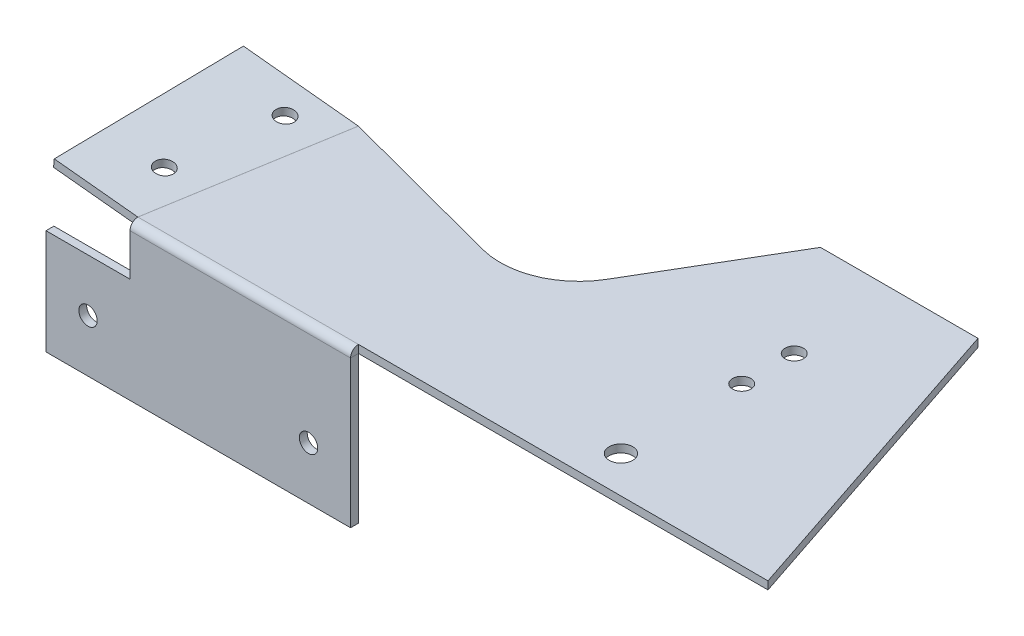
SolidWorks part; units mm, degrees
ref_plane "Front Plane" through (0, 0, 0) normal (0, 0, 1) x (1, 0, 0)
ref_plane "Top Plane" through (0, 0, 0) normal (0, 1, 0) x (1, 0, 0)
ref_plane "Right Plane" through (0, 0, 0) normal (1, 0, 0) x (0, 0, -1)
sketch "Sketch1" plane through (0, 0, 0) normal (0, 1, 0) x (1, 0, 0)
  line L0 (0, 0) -> (58, 0)
  line L1 (58, 0) -> (58, 28)
  line L2 (58, 28) -> (136, 28)
  line L3 (136, 28) -> (116, 88)
  line L4 (116, 88) -> (86, 88)
  line L5 (86, 88) -> (70.927, 62.3913)
  line L6 (54.167, 55.498) -> (22, 64)
  line L7 (22, 64) -> (0, 64)
  line L8 (0, 64) -> (0, 28)
  line L9 (0, 28) -> (16, 28)
  line L10 (16, 28) -> (16, 20)
  line L11 (16, 20) -> (0, 20)
  line L12 (0, 20) -> (0, 0)
  line L13 (0, 10) -> (58, 10) construction
  line L14 (101, 28) -> (101, 71.9333) construction
  arc A0 (54.167, 55.498) -> (70.927, 62.3913) centre (58, 70) ccw
  circle A1 centre (8, 10) radius 1.75
  circle A2 centre (50, 10) radius 1.75
  circle A3 centre (101, 35) radius 2.25
  circle A4 centre (101, 58) radius 1.75
  circle A5 centre (101, 68) radius 1.75
  circle A6 centre (14, 58) radius 1.75
  circle A7 centre (11, 38) radius 1.75
  dimension "D11" = 15
  dimension "D15" = 4.5
  dimension "D16" = 3.5
  dimension "D18" = 8
  dimension "D19" = 8
  dimension "D20" = 11
  dimension "D21" = 14
  dimension "D23" = 20
  dimension "D25" = 7
  dimension "D26" = 10
  dimension "D27" = 30
  dimension "D1" = 58
  dimension "D2" = 60
  dimension "D3" = 20
  dimension "D4" = 8
  dimension "D5" = 36
  dimension "D6" = 28
  dimension "D7" = 136
  dimension "D8" = 20
  dimension "D9" = 30
  dimension "D10" = 22
  dimension "D12" = 36
  dimension "D13" = 18
  dimension "D14" = 16
  dimension "D17" = 10
  dimension "D22" = 10
  dimension "D24" = 35
sheet metal parameters "Sheet-Metal1" thickness 1.5 parameters "D1"=1
base flange "Base-Flange1" sketch "Sketch1" thickness 1.5 reverse thickness direction yes parameters "D1"=1
sketch "Sketch2" plane through (0, 0, 0) normal (0, -1, 0) x (1, 0, 0)
  line L0 (16, -28) -> (58, -28)
sketched bend "Sketched Bend1" parameters "D1"=0.001
bend "SketchBend1" bend radius 0.001 bend angle 90 parameters "D5"=1
sketch "Sketch3" plane through (0, 0, 0) normal (0, -1, 0) x (1, 0, 0)
  line L0 (16, -28) -> (22, -64)
sketched bend "Sketched Bend4" parameters "D1"=0.1
bend "SketchBend4" bend radius 0.1 bend angle 6 parameters "D5"=2
flat pattern "Flat-Pattern1"
sketch "Bend-Lines1" plane through (0, 0, 0) normal (0, 1, 0) x (-1, 0, 0)
bend of the flat pattern "Flatten-<SketchBend1>1"
bend of the flat pattern "Flatten-<SketchBend4>1"
